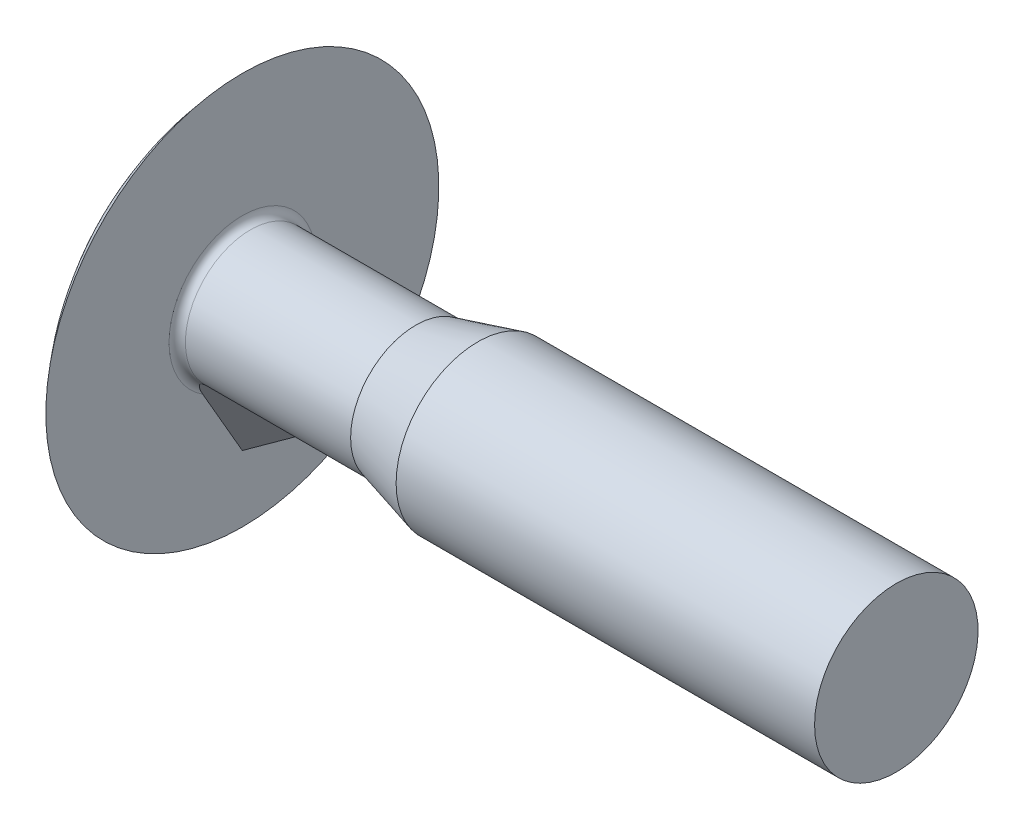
SolidWorks part; units mm, degrees
ref_plane "Front" through (0, 0, 0) normal (0, 0, 1) x (1, 0, 0)
ref_plane "Top" through (0, 0, 0) normal (0, 1, 0) x (1, 0, 0)
ref_plane "Right" through (0, 0, 0) normal (1, 0, 0) x (0, 0, -1)
other "Configuration Table"
sketch "Sketch1" plane through (-7.6906, 4.3277, 0) normal (0, 0, 1) x (0, 1, 0)
  line L0 (-4.3277, -12.2906) -> (-16.3461, -12.2906)
  line L1 (-4.3277, 1.3165) -> (-4.3277, -29.2605) construction
  line L2 (-4.3277, -12.2906) -> (-4.3277, -7.6906)
  arc A0 (-4.3277, -7.6906) -> (-16.3461, -12.2906) centre (-4.3277, -25.6906) ccw
  dimension "r" = 18
  dimension "k" = 4.6
revolve "BaseHead" add sketch "Sketch1" angle 360 about L1
sketch "Sketch2" plane through (4.6, 0, 0) normal (1, 0, 0) x (0, 0, -1)
  circle A0 centre (0, 0) radius 5
extrude "BaseBody" add sketch "Sketch2" along normal blind 40
sketch "Sketch3" plane through (-15.8544, 0, 20.8544) normal (0, 1, 0) x (0, 0, -1)
  line L0 (20.8544, 6.1636) -> (20.8544, -42.8724) construction
  line L1 (25.8544, -34.8604) -> (24.8362, -31.0604)
  line L2 (20.8544, -60.4544) -> (20.8544, -20.4544) construction
  line L3 (24.8362, -31.0604) -> (24.8362, -20.4544)
  line L4 (25.8544, -60.4544) -> (25.8544, -20.4544) construction
  line L5 (24.8362, -20.4544) -> (25.8544, -20.4544)
  line L6 (25.8544, -20.4544) -> (25.8544, -34.8604)
  line L7 (15.8544, -20.4544) -> (25.8544, -20.4544) construction
  line L8 (8.8361, -20.4544) -> (32.8727, -20.4544) construction
  line L9 (15.8544, -60.4544) -> (25.8544, -60.4544) construction
  dimension "D1" = 15
  dimension "x" = 3.8
revolve "Cut-Revolve1" cut sketch "Sketch3" angle 360 about L0
fillet "Fillet1" radius 0.5 1 edges at (4.6, 0, 3.9818)
ref_plane "Plan1" through (10.1, 0, 0) normal (1, 0, 0) x (0, 0, -1)
sketch "Sketch4" plane through (4.6, 10.7187, 8.8426) normal (1, 0, 0) x (0, 0, 1)
  line L0 (-12.291, 12.7096) -> (-8.8426, 18.6823)
  line L1 (-8.8426, 18.6823) -> (-5.3943, 12.7096)
  line L2 (-12.291, 12.7096) -> (-5.3943, 12.7096)
  circle A0 centre (-8.8426, 10.7187) radius 3.9818 construction
  point P5 (-8.8426, 12.7096)
  dimension "D1" = 60
sketch "Sketch5" plane through (10.1, 0, 0) normal (1, 0, 0) x (0, 0, -1)
  line L0 (0, 0) -> (0, -9.3883) construction
  circle A0 centre (0, 0) radius 3.9818 construction
  circle A1 centre (0, 0) radius 3.9818 construction
  point P6 (0, -3.9818)
loft "Nib" add profiles "Sketch4", "Sketch5"
sketch "Sketch6" plane through (0, 0, 0) normal (0, 0, 1) x (1, 0, 0)
  line L0 (44.194, 5.2) -> (45.006, 5.2)
  line L1 (45.006, 5.2) -> (45.006, 5)
  line L2 (45.006, 5) -> (44.6, 4.2968)
  line L3 (44.194, 5) -> (44.6, 4.2968)
  line L4 (44.194, 5.2) -> (44.194, 5)
  line L5 (44.6, -5) -> (44.6, 5) construction
  line L6 (44.194, 5) -> (45.006, 5) construction
  line L7 (44.6, 5) -> (44.6, 4.2968) construction
  line L8 (44.6, 5) -> (19.006, 5) construction
  line L9 (0, 0) -> (56.0764, 0) construction
  point P5 (44.6, 5.2)
revolve "Cut-Revolve10" [suppressed] cut sketch "Sketch6" angle 360 about L9
pattern_linear "LPattern10" [suppressed] count 26 spacing 0.9744 along (1, 0, 0)
equation "\"D2@Sketch6\" = (  \"d@Sketch2\" - \"D2@ThreadCosmetic1\" )  / 2"
equation "\"D3@LPattern10\" = 1.2 * \"D2@Sketch6\""
equation "\"D1@LPattern10\" = \"b@ThreadCosmetic1\" / \"D3@LPattern10\""
